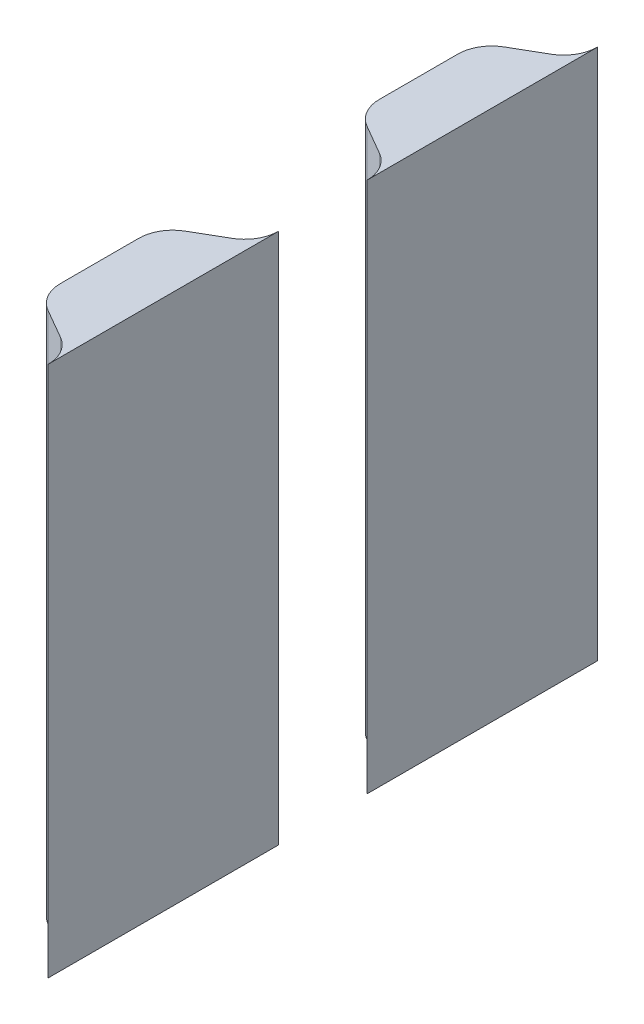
SolidWorks part; units mm, degrees
ref_plane "Face" through (0, 0, 0) normal (0, 0, 1) x (1, 0, 0)
ref_plane "Dessus" through (0, 0, 0) normal (0, 1, 0) x (1, 0, 0)
ref_plane "Droite" through (0, 0, 0) normal (1, 0, 0) x (0, 0, -1)
sketch "Esquisse1" plane through (0, 0, 0) normal (0, 1, 0) x (1, 0, 0)
  line L0 (60, 2.0762) -> (60, 12.9221)
  line L1 (60, 17.0779) -> (60, 27.9238)
  line L16 (60, 17.0779) -> (60, 12.9221)
  line L23 (59.2, 3.4619) -> (57.8, 4.2702)
  line L24 (57, 5.6558) -> (57, 9.3396)
  line L25 (57.7978, 10.724) -> (59.2022, 11.5377)
  line L110 (59.2, 26.5381) -> (57.8, 25.7298)
  line L133 (57, 24.3442) -> (57, 20.6604)
  line L137 (57.7978, 19.276) -> (59.2022, 18.4623)
  arc A3 (59.2022, 11.5377) -> (60, 12.9221) centre (58.4, 12.9221) ccw
  arc A6 (60, 2.0762) -> (59.2, 3.4619) centre (58.4, 2.0762) ccw
  arc A7 (57.8, 4.2702) -> (57, 5.6558) centre (58.6, 5.6558) cw
  arc A8 (57, 9.3396) -> (57.7978, 10.724) centre (58.6, 9.3396) cw
  arc A21 (60, 27.9238) -> (59.2, 26.5381) centre (58.4, 27.9238) cw
  arc A22 (57.8, 25.7298) -> (57, 24.3442) centre (58.6, 24.3442) ccw
  arc A23 (57, 20.6604) -> (57.7978, 19.276) centre (58.6, 20.6604) ccw
  arc A24 (59.2022, 18.4623) -> (60, 17.0779) centre (58.4, 17.0779) cw
  dimension "D12" = 1.6
extrude "Extrusion1" add sketch "Esquisse1" along normal blind 25 contours A8 L24 A7 L23 A6 L0 A3 L25 | L137 A24 L1 A21 L110 A22 L133 A23
